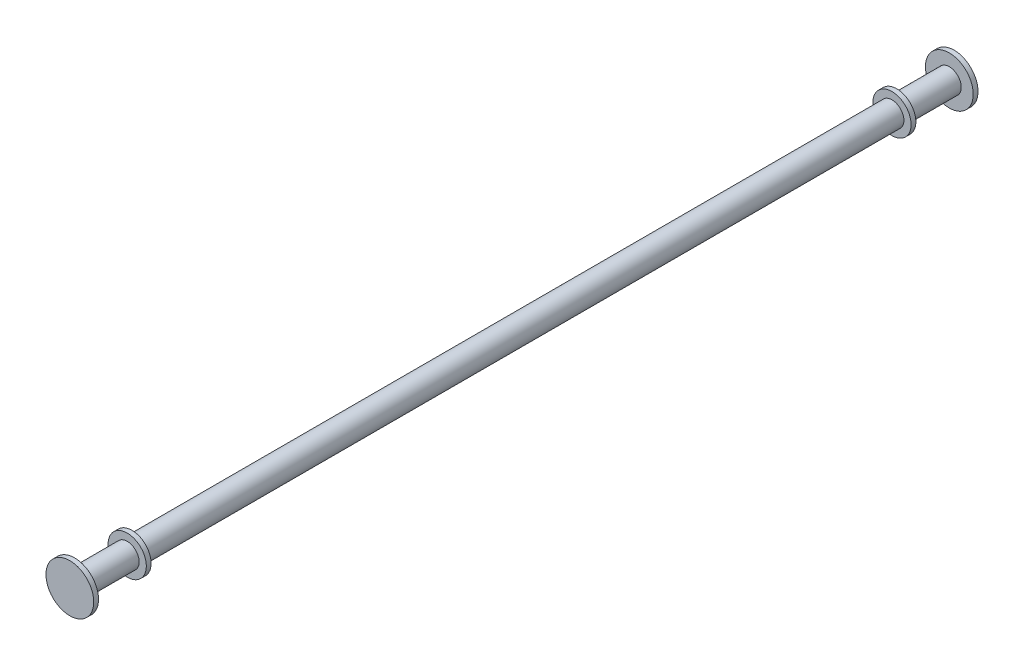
SolidWorks part; units mm, degrees
ref_plane "Front Plane" through (0, 0, 0) normal (0, 0, 1) x (1, 0, 0)
ref_plane "Top Plane" through (0, 0, 0) normal (0, 1, 0) x (1, 0, 0)
ref_plane "Right Plane" through (0, 0, 0) normal (1, 0, 0) x (0, 0, -1)
sketch "Sketch2" plane through (0, 0, 0) normal (0, 0, 1) x (1, 0, 0)
  circle A0 centre (0, 0) radius 2.5
extrude "Boss-Extrude1" add sketch "Sketch2" along normal blind 185
ref_plane "Plane2" through (0, 0, 172) normal (0, 0, 1) x (1, 0, 0)
sketch "Sketch4" plane through (0, 0, 172) normal (0, 0, 1) x (1, 0, 0)
  circle A0 centre (0, 0) radius 4
  dimension "D1" = 8
extrude "Boss-Extrude2" add sketch "Sketch4" along normal blind 1
ref_plane "Plane3" through (0, 0, 92.5) normal (0, 0, 1) x (1, 0, 0)
mirror "Mirror1" about plane through (0, 0, 92.5) normal (0, 0, 1) of "Boss-Extrude2"
ref_plane "Plane4" through (0, 0, 184) normal (0, 0, 1) x (1, 0, 0)
sketch "Sketch5" plane through (0, 0, 184) normal (0, 0, 1) x (1, 0, 0)
  circle A0 centre (0, 0) radius 5
extrude "Boss-Extrude3" add sketch "Sketch5" along normal blind 1
mirror "Mirror2" about plane through (0, 0, 92.5) normal (0, 0, 1) of "Boss-Extrude3"
